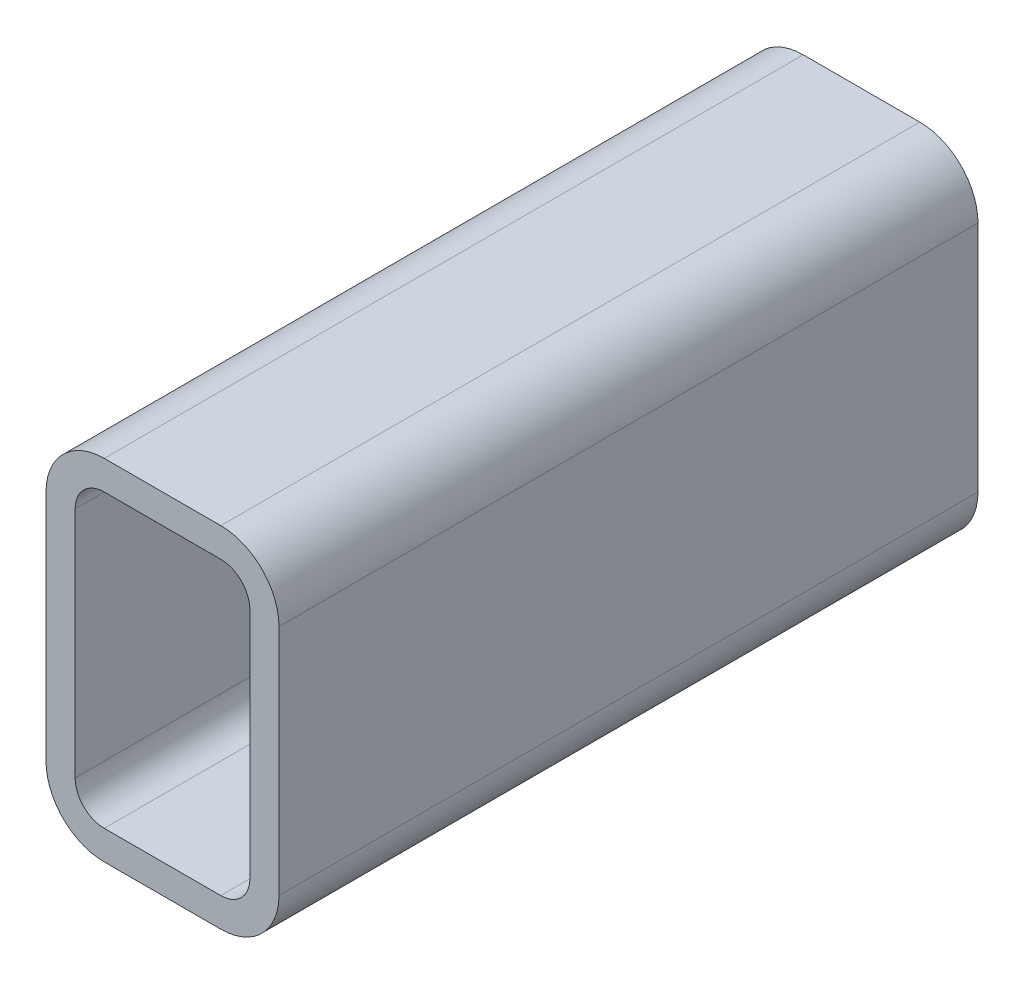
SolidWorks part; units mm, degrees
ref_plane "Front Plane" through (0, 0, 0) normal (0, 0, 1) x (1, 0, 0)
ref_plane "Top Plane" through (0, 0, 0) normal (0, 1, 0) x (1, 0, 0)
ref_plane "Right Plane" through (0, 0, 0) normal (1, 0, 0) x (0, 0, -1)
sketch "Sketch1" plane through (0, 0, 0) normal (0, 0, 1) x (1, 0, 0)
  point P0 (0, 0)
sketch_block_instance "HSS6x4x0.500-1"
sketch_block "HSS6x4x0.500"
extrude "Boss-Extrude1" add sketch "Sketch1" along normal blind 304.8
